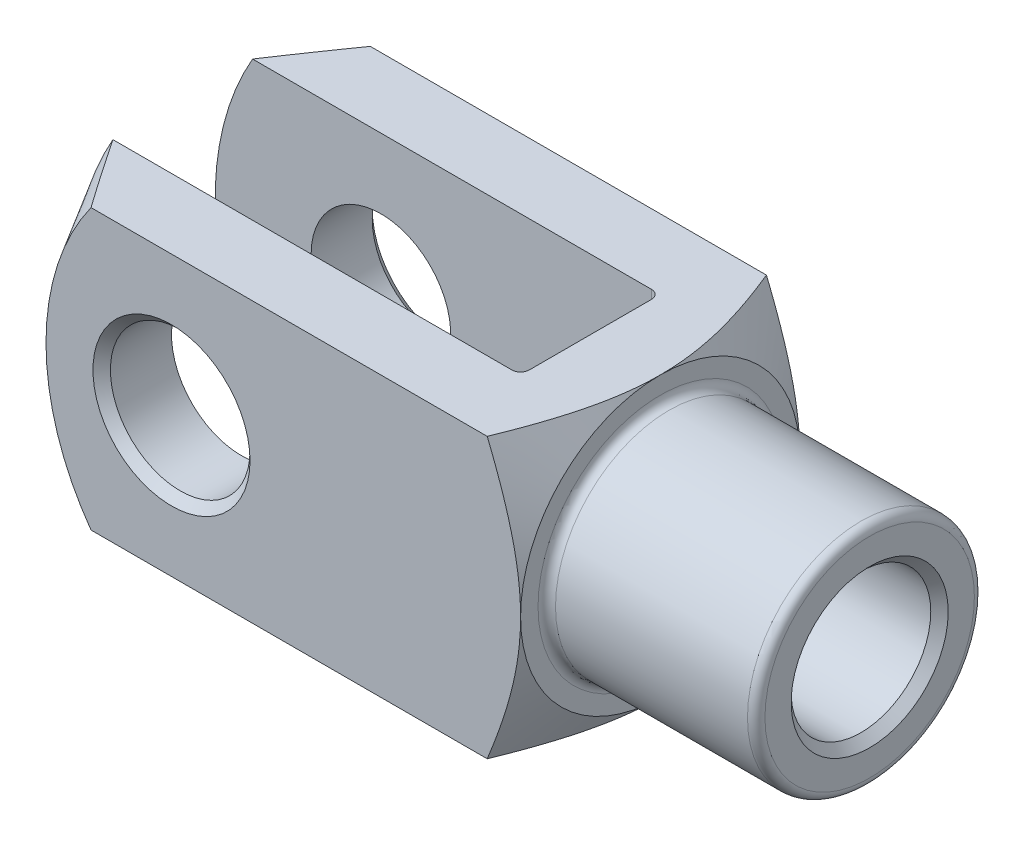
SolidWorks part; units mm, degrees
ref_plane "Front Plane" through (0, 0, 0) normal (0, 0, 1) x (1, 0, 0)
ref_plane "Top Plane" through (0, 0, 0) normal (0, 1, 0) x (1, 0, 0)
ref_plane "Right Plane" through (0, 0, 0) normal (1, 0, 0) x (0, 0, -1)
sketch "Sketch1" plane through (0, 0, 0) normal (1, 0, 0) x (0, 0, -1)
  line L0 (0, 0) -> (0, 50000) construction
  line L1 (0, 0) -> (50000, 0) construction
  line L2 (-16, -16) -> (-16, 16)
  line L3 (-16, 16) -> (16, 16)
  line L4 (16, -16) -> (16, 16)
  line L5 (-16, -16) -> (16, -16)
  point P9 (0, 16)
  point P11 (16, 0)
  point P12 (-16, 0)
  dimension "D1" = 32
  dimension "D2" = 32
extrude "Extrude1" add sketch "Sketch1" against normal blind 83
sketch "Sketch2" plane through (0, 0, 0) normal (1, 0, 0) x (0, 0, -1)
  circle A0 centre (0, 0) radius 13
  circle A1 centre (0, 0) radius 26
  dimension "D1" = 26
  dimension "D2" = 52
extrude "Extrude2" cut sketch "Sketch2" against normal blind 24
sketch "Sketch3" plane through (0, 0, 16) normal (0, 0, 1) x (1, 0, 0)
  circle A0 centre (-64, 0) radius 8
  dimension "D1" = 16
  dimension "D2" = 64
extrude "Extrude3" cut sketch "Sketch3" against normal through all
sketch "Sketch4" plane through (0, 16, 0) normal (0, 1, 0) x (1, 0, 0)
  line L0 (0, 0) -> (-50000, 0) construction
  line L1 (-83, -8) -> (-83, 8)
  line L2 (-83, 16) -> (-83, -16) construction
  line L3 (-83, 8) -> (-32, 8)
  line L4 (-32, 8) -> (-32, -8)
  line L5 (-64, 16) -> (-64, -16) construction
  line L6 (-83, -8) -> (-32, -8)
  point P7 (-64, 0)
  point P13 (-32, 0)
  point P14 (-83, 0)
  dimension "D1" = 32
  dimension "D2" = 16
extrude "Extrude4" cut sketch "Sketch4" against normal through all
fillet "Fillet1" radius 1 2 edges at (-32, 0, 8) (-32, 0, -8)
fillet "Fillet2" radius 1 2 edges at (0, 0, -13) (-24, 0, -13)
chamfer "Chamfer2" distance 1 angle 45 2 edges at (-56, 0, -16) (-56, 0, 16)
sketch "Sketch6" plane through (0, 0, 0) normal (0, 0, 1) x (1, 0, 0)
  line L0 (-24, -16) -> (-24, -32)
  line L1 (-24, -32) -> (-33.2376, -32)
  line L2 (-33.2376, -32) -> (-24, -16)
  dimension "D1" = 30
  dimension "D2" = 32
revolve "Cut-Revolve1" cut sketch "Sketch6" angle 360 about axis through (-24, 0, 0) along (1, 0, 0)
sketch "Sketch7" plane through (0, 0, 0) normal (0, 1, 0) x (1, 0, 0)
  line L0 (-78.3812, -16) -> (-83, -8)
  line L1 (-83, 8) -> (-78.3812, 16)
  line L2 (-78.3812, 16) -> (-115, 16)
  line L3 (-83, 8) -> (-83, -8)
  line L4 (-115, 16) -> (-115, -16)
  line L5 (-115, -16) -> (-78.3812, -16)
  line L6 (-83, 16) -> (-27.8263, 16) construction
  line L7 (-83, -16) -> (-27.8263, -16) construction
  line L8 (-51, 0.6162) -> (-51, 50000.6162) construction
  dimension "D1" = 120
  dimension "D2" = 32
  dimension "D3" = 32
revolve "Cut-Revolve2" cut sketch "Sketch7" angle 180 about L8
sketch "Sketch8" plane through (0, 0, 0) normal (1, 0, 0) x (0, 0, -1)
  circle A0 centre (0, 0) radius 8
  dimension "D1" = 16
extrude "Extrude5" cut sketch "Sketch8" against normal through all
chamfer "Chamfer3" distance 1 angle 45 1 edges at (0, 0, -8)
equation "\"D2@Sketch1\" = \"D1@Sketch1\""
equation "\"D2@Sketch2\" = \"D1@Sketch2\"*2"
equation "\"D2@Sketch6\" = \"D1@Sketch1\""
equation "\"D2@Sketch7\" = \"D1@Sketch1\""
equation "\"D3@Sketch7\" = \"D1@Sketch1\""
